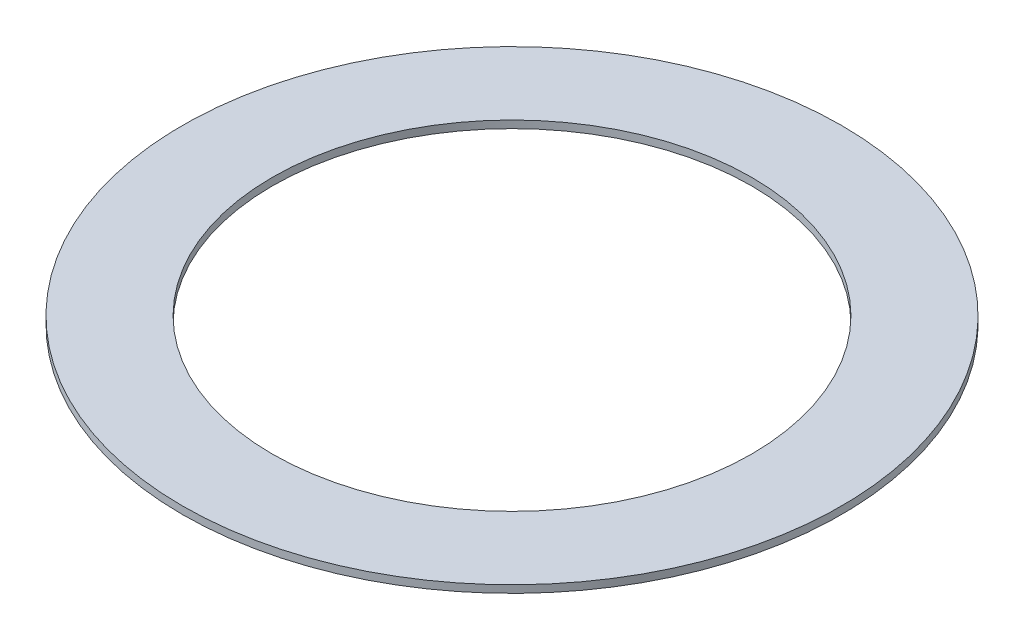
SolidWorks part; units mm, degrees
ref_plane "Front Plane" through (0, 0, 0) normal (0, 0, 1) x (1, 0, 0)
ref_plane "Top Plane" through (0, 0, 0) normal (0, 1, 0) x (1, 0, 0)
ref_plane "Right Plane" through (0, 0, 0) normal (1, 0, 0) x (0, 0, -1)
sketch "Sketch1" plane through (0, 0, 0) normal (0, 1, 0) x (1, 0, 0)
  circle A0 centre (0, 0) radius 25.4
  circle A1 centre (0, 0) radius 34.925
  dimension "D1" = 69.85
  dimension "D2" = 50.8
extrude "Boss-Extrude1" add sketch "Sketch1" along normal blind 0.7937
